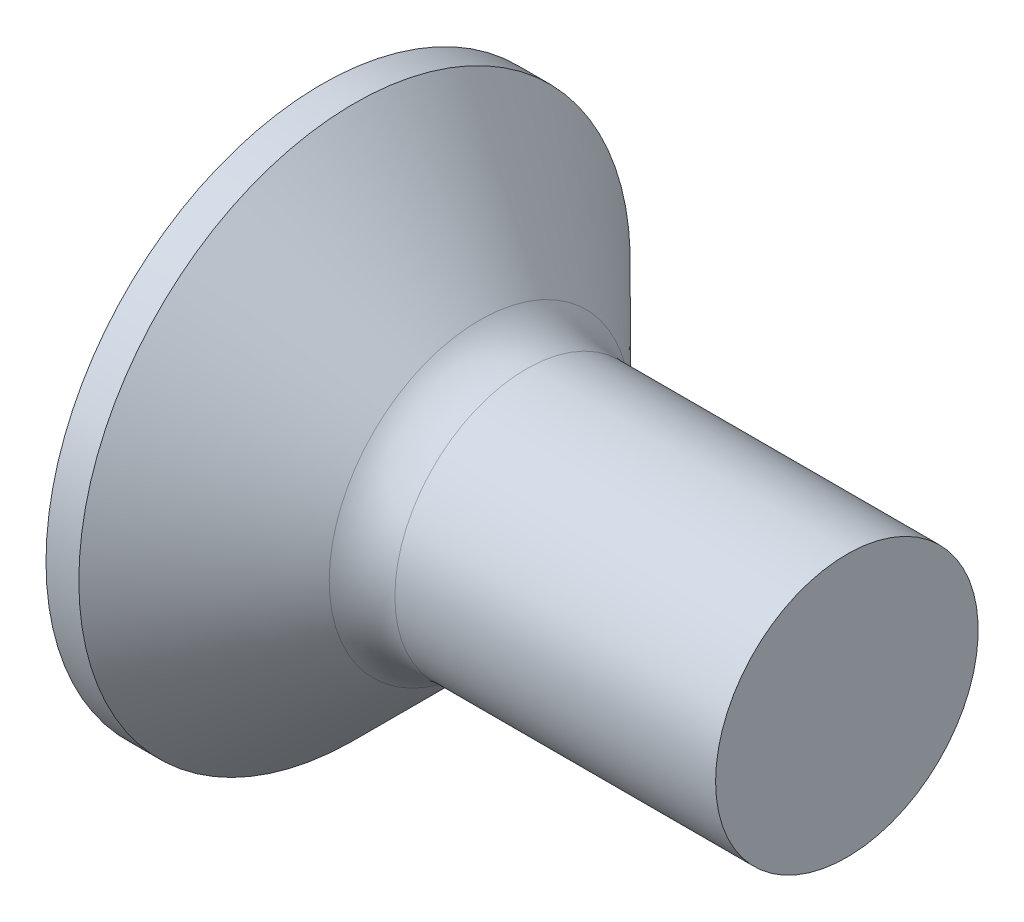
SolidWorks part; units mm, degrees
ref_plane "Plane1" through (0, 0, 0) normal (0, 0, 1) x (1, 0, 0)
ref_plane "Plane2" through (0, 0, 0) normal (0, 1, 0) x (1, 0, 0)
ref_plane "Plane3" through (0, 0, 0) normal (1, 0, 0) x (0, 0, -1)
revolve "Base-Revolve" add sketch "BodySke"
sketch "BodySke" plane through (0, 0, 0) normal (0, 0, 1) x (1, 0, 0)
  line L0 (0, 0) -> (0, 4.2)
  line L1 (0, 4.2) -> (0.5, 4.2)
  line L2 (2.7, 2) -> (8, 2)
  line L3 (8, 2) -> (8, 0)
  line L4 (8, 0) -> (0, 0)
  line L5 (-6.35, 0) -> (82.55, 0) construction
  line L6 (2.7, -2) -> (8, -2) construction
  line L7 (0.5, -4.2) -> (2.7, -2) construction
  line L8 (0.5, 4.2) -> (2.7, 2)
  line L9 (0, -4.2) -> (0.5, -4.2) construction
  line L10 (3.4, 3.5875) -> (3.4, -5.9375) construction
  line L11 (0, 6.35) -> (0, -3.175) construction
  dimension "Diameter" = 4
  dimension "Length" = 8
  dimension "Head_ht" = 2.7
  dimension "Head_dia" = 8.4
  dimension "Head_ang" = 90
  dimension "D6" = 0.5
  dimension "Advance" = 0.7
  dimension "Thread_nom" = 8
fillet "Fillet1" radius 1 1 edges at (2.7, 0, 2)
sketch "Sketch3" plane through (0, 0, 0) normal (-1, 0, 0) x (0, 0, 1)
  line L0 (-0.515, 2.2) -> (0.515, 2.2)
  line L1 (0.515, 2.2) -> (0.515, -2.2)
  line L2 (0.515, -2.2) -> (-0.515, -2.2)
  line L3 (-0.515, -2.2) -> (-0.515, 2.2)
  dimension "D1" = 2.2
  dimension "Cross_dia" = 4.4
  dimension "D2" = 0.515
  dimension "Cross_width" = 1.03
ref_plane "Plane4" through (2.51, 0, 0) normal (-1, 0, 0) x (0, 0, 1)
sketch "Sketch4" plane through (2.51, 0, 0) normal (-1, 0, 0) x (0, 0, 1)
  line L0 (-0.515, 0.9486) -> (0.515, 0.9486)
  line L3 (0.515, 0.9486) -> (0.515, -0.9486)
  line L4 (0.515, -0.9486) -> (-0.515, -0.9486)
  line L5 (-0.515, -0.9486) -> (-0.515, 0.9486)
  dimension "D1" = 1.03
  dimension "D2" = 1.8971
  dimension "D3" = 0.515
  dimension "D4" = 0.9486
loft "Recess" cut profiles "Sketch3", "Sketch4"
pattern_circular "RecPat" count 2 every 90 about axis through (0, 0, 0) along (1, 0, 0) of "Recess"
sketch "RecCorSke" plane through (0, 0, 0) normal (0, 0, 1) x (1, 0, 0)
  line L0 (-3.175, 0) -> (15.875, 0) construction
  line L2 (0, 0) -> (0, 1.0265)
  line L3 (0, 1.0265) -> (2.51, 0.851)
  line L4 (2.51, 0.851) -> (2.7865, 0)
  line L5 (2.7865, 0) -> (0, 0)
  dimension "Diameter" = 1.702
  dimension "Depth" = 2.51
  dimension "Draft_angle" = 4
  dimension "Bottom_angle" = 18
revolve "RecessCore" cut sketch "RecCorSke" angle 360 about L0
sketch "ThdSchSke" plane through (0, 0, 0) normal (0, 0, 1) x (1, 0, 0)
  line L0 (3.4, -1.61) -> (3.1269, -2)
  line L1 (3.4, -1.61) -> (3.6731, -2)
  line L2 (3.6731, -2) -> (3.6731, -2.5)
  line L3 (-3.175, 0) -> (5.1513, 0) construction
  line L5 (3.6731, -2.5) -> (3.1269, -2.5)
  line L6 (3.1269, -2.5) -> (3.1269, -2)
  line L7 (0, 4.2) -> (0, -4.2) construction
  dimension "Thread_minor" = 3.22
  dimension "Diameter" = 4
  dimension "Start" = 3.4
  dimension "SideAngle" = 55
  dimension "VeeAngle" = 70
  dimension "Overcut" = 5
revolve "ThreadSchematic" [suppressed] cut sketch "ThdSchSke" angle 360 about L3
pattern_linear "ThdSchPat" [suppressed]
equation "\"D1@Sketch3\" = \"Cross_dia@Sketch3\" / 2"
equation "\"D2@Sketch3\" = \"Cross_width@Sketch3\" / 2"
equation "\"Depth@RecCorSke\" = \"Cross_depth@Plane4\""
equation "\"D1@Sketch4\" = \"Cross_width@Sketch3\""
equation "\"D2@Sketch4\" = \"Cross_dia@Sketch3\" - 2.0 * \"Cross_depth@Plane4\" * tan(26.5  * 0.017453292)"
equation "\"D3@Sketch4\" = \"D1@Sketch4\" / 2"
equation "\"D4@Sketch4\" = \"D2@Sketch4\" / 2"
equation "\"Thread_length@ThreadCosmetic\" = ((sgn( (\"Length@BodySke\" - \"Advance@BodySke\" * 1.0 - \"Head_ht@BodySke\" ) - \"Thread_nom@BodySke\" )-1)*( (\"Length@BodySke\" - \"Advance@BodySke\" * 1.0 - \"Head_ht@BodySke\" "
equation "\"Thread_minor@ThdSchSke\" = \"Thread_minor@ThreadCosmetic\""
equation "\"Diameter@ThdSchSke\" = \"Diameter@BodySke\""
equation "\"Overcut@ThdSchSke\" = \"Diameter@BodySke\" * 1.25"
equation "\"Start@ThdSchSke\" = 0.000001 + \"Length@BodySke\" - \"Thread_length@ThreadCosmetic\"  '---Countersunk---"
equation "\"Num_threads@ThdSchPat\" = int( \"Thread_length@ThreadCosmetic\" / \"Advance@BodySke\" + 0.999 )  + 1"
equation "\"Advance@ThdSchPat\" = \"Thread_length@ThreadCosmetic\" /  (\"Num_threads@ThdSchPat\" - 1) 'relax it"
